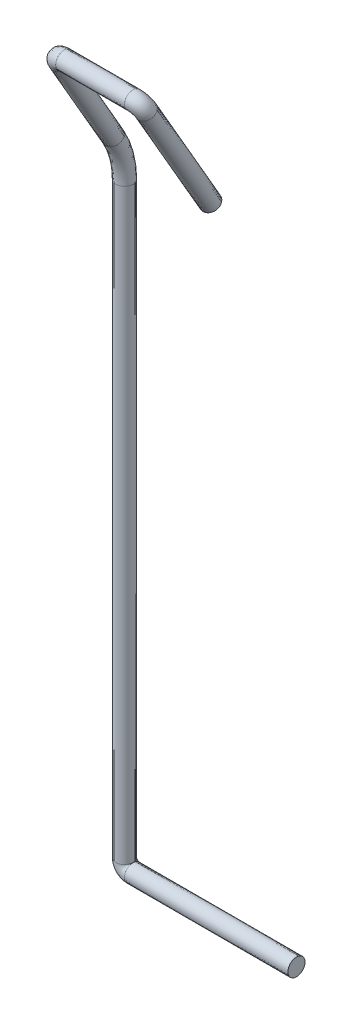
SolidWorks part; units mm, degrees
ref_plane "Plan de face" through (0, 0, 0) normal (0, 0, 1) x (1, 0, 0)
ref_plane "Plan de dessus" through (0, 0, 0) normal (0, 1, 0) x (1, 0, 0)
ref_plane "Plan de droite" through (0, 0, 0) normal (1, 0, 0) x (0, 0, -1)
sketch "Esquisse1" plane through (0, 0, 0) normal (1, 0, 0) x (0, 0, -1)
  circle A0 centre (0, 0) radius 0.5
ref_plane "Plan1" through (0, 0, 0) normal (0, 0, 1) x (1, 0, 0)
sketch3d "Esquisse3D1"
  line L0 (0, 0, 0) -> (-9.5, 0, 0)
  line L1 (-10, 0.5, 0) -> (-10, 34.6603, 0)
  line L2 (-10, 37.1603, 0.6699) -> (-10, 42.4952, 3.75)
  line L3 (-9.5, 42.9282, 4) -> (-5.5, 42.9282, 4)
  line L4 (-5, 42.4952, 3.75) -> (-5, 36, 0)
  arc A0 (-5.5, 42.9282, 4) -> (-5, 42.4952, 3.75) centre (-5.5, 42.4952, 3.75) ccw
  arc A1 (-10, 42.4952, 3.75) -> (-9.5, 42.9282, 4) centre (-9.5, 42.4952, 3.75) ccw
  arc A2 (-9.5, 0, 0) -> (-10, 0.5, 0) centre (-9.5, 0.5, 0) ccw
  arc A3 (-10, 34.6603, 0) -> (-10, 37.1603, 0.6699) centre (-10, 34.6603, 5) ccw
  point P9 (-5, 42.9282, 4)
  point P10 (-5.5, 42.7452, 3.317)
  point P13 (-10, 42.9282, 4)
  point P14 (-9.5, 42.7452, 3.317)
  point P17 (-10, 0, 0)
  point P18 (-9.5, 0.5, -0.5)
  point P21 (-10, 36, 0)
  point P22 (-5, 34.6603, 5)
  dimension "D3" = 0.5
  dimension "D4" = 5
  dimension "D1" = 150
  dimension "D2" = 8
sweep "Balayage2" add profiles "Esquisse1" path "Esquisse3D1"
